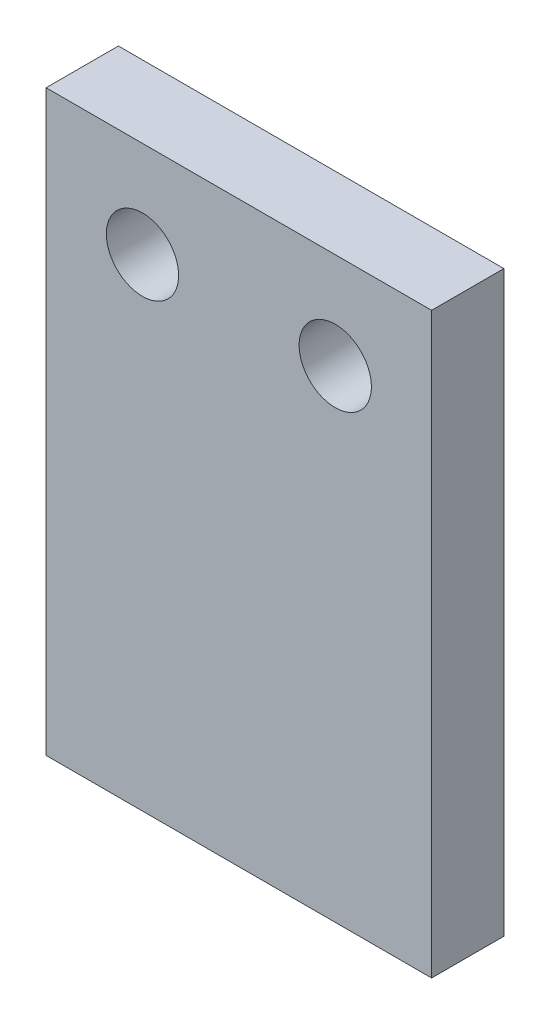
SolidWorks part; units mm, degrees
ref_plane "Plane1" through (0, 0, 0) normal (0, 0, 1) x (1, 0, 0)
ref_plane "Plane2" through (0, 0, 0) normal (0, 1, 0) x (1, 0, 0)
ref_plane "Plane3" through (0, 0, 0) normal (1, 0, 0) x (0, 0, -1)
sketch "Sketch1"
  dimension "D6" = 19.05
  dimension "D1" = 12.7
  dimension "D2" = 12.7
  dimension "D3" = 12.7
  dimension "D4" = 152.4
  dimension "D5" = 25.4
  dimension "D7" = 25.4
  dimension "D8" = 25.4
extrude "Base-Extrude" add sketch "Sketch1" along normal blind 19.05
